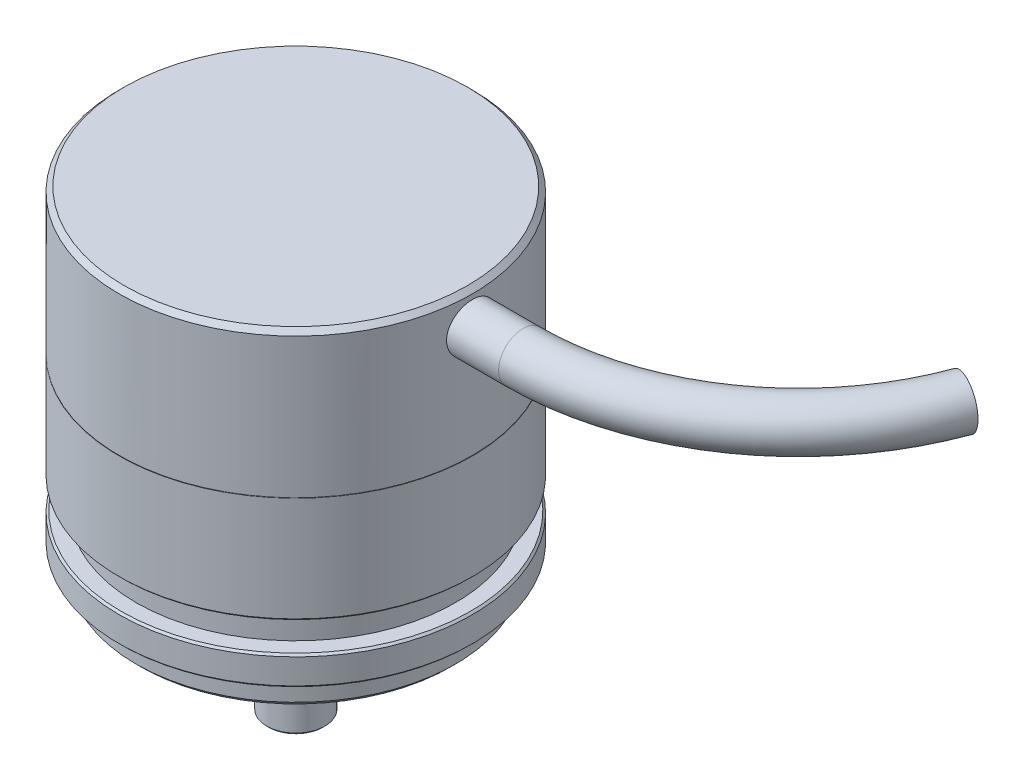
SolidWorks part; units mm, degrees
ref_plane "Plane1" through (0, 0, 0) normal (0, 0, 1) x (1, 0, 0)
ref_plane "Plane2" through (0, 0, 0) normal (0, 1, 0) x (1, 0, 0)
ref_plane "Plane3" through (0, 0, 0) normal (1, 0, 0) x (0, 0, -1)
sketch "Sketch1" plane through (0, 0, 0) normal (0, 0, 1) x (1, 0, 0)
  line L1 (49.7963, 36) -> (49.7963, 21.05)
  line L2 (41.0963, 1) -> (48.0463, 1)
  line L4 (49.7963, 4) -> (48.0463, 4)
  line L5 (49.7963, 7) -> (48.0463, 7)
  line L6 (49.7963, 4) -> (49.7963, 7)
  line L7 (48.0463, 1) -> (48.0463, 4)
  line L8 (49.7963, 10) -> (48.0463, 10)
  line L9 (48.0463, 7) -> (48.0463, 10)
  line L10 (34.5463, 1.1) -> (34.65, 1)
  line L11 (41.0963, 1) -> (41.0963, 1.1)
  line L12 (31.5463, -11) -> (34.5463, -11)
  line L13 (34.5463, -11) -> (34.5463, 1.1)
  line L14 (49.7963, 36) -> (31.5463, 36)
  line L15 (31.5463, -11) -> (31.5463, 0.4309) construction
  line L16 (34.65, 1) -> (35.4, 1)
  line L17 (35.4, 1) -> (35.4, 1.1)
  line L20 (35.4, 1.1) -> (39.5, 1.1)
  line L22 (39.75, 1.0147) -> (40.9814, 1.0147)
  line L23 (40.9814, 1.0147) -> (40.9814, 1.1)
  line L24 (40.9814, 1.1) -> (41.0963, 1.1)
  line L25 (31.5463, -11) -> (31.5463, 36)
  line L26 (49.7963, 21) -> (49.75, 21)
  line L27 (49.75, 21) -> (49.75, 21.05)
  line L28 (49.75, 21.05) -> (49.7963, 21.05)
  line L29 (49.7963, 21) -> (49.7963, 10)
  line L30 (39.5, 1.1) -> (39.75, 1.1)
  line L31 (39.75, 1.1) -> (39.75, 1.0147)
  dimension "D1" = 12
  dimension "D2" = 3
  dimension "D3" = 35
revolve "Base-Revolve" add sketch "Sketch1" angle 360 about L15
chamfer "Chamfer1" distance 0.5 angle 45 2 edges at (31.5463, 36, -18.25) (31.5463, 1, -16.5)
ref_plane "Plane4" through (20, 0, 0) normal (1, 0, 0) x (0, 0, -1)
sketch "Sketch2" plane through (20, 0, 0) normal (1, 0, 0) x (0, 0, -1)
  line L0 (0, 35.5) -> (0, 36) construction
  line L1 (17.75, 36) -> (-17.75, 36) construction
  circle A0 centre (0, 32.5) radius 2.5
  dimension "D2" = 5
  dimension "D1" = 3.5
extrude "Boss-Extrude1" add sketch "Sketch2" along normal blind 35
sketch "Sketch3" plane through (55, 0, 0) normal (1, 0, 0) x (0, 0, -1)
  line L0 (28.5, 36.7) -> (28.5, 22.8) construction
  circle A2 centre (0, 32.5) radius 2.5
  circle A3 centre (0, 32.5) radius 2.5
  dimension "D1" = 0
revolve "Boss-Revolve1" add sketch "Sketch3" angle 70 about L0
sketch "Sketch4" plane through (0, 1, 0) normal (0, -1, 0) x (1, 0, 0)
  circle A2 centre (40.7387, 9.1924) radius 1.35
  circle A4 centre (40.7387, -9.1924) radius 1.35
  circle A6 centre (22.3539, -9.1924) radius 1.35
  circle A8 centre (22.3539, 9.1924) radius 1.35
extrude "Cut-Extrude1" cut sketch "Sketch4" against normal blind 6
sketch "Sketch5" plane through (0, 7, 0) normal (0, -1, 0) x (1, 0, 0)
  circle A2 centre (40.7387, 9.1924) radius 1.35
  circle A3 centre (40.7387, 9.1924) radius 1.35
  circle A5 centre (40.7387, -9.1924) radius 1.35
  circle A6 centre (40.7387, -9.1924) radius 1.35
  circle A8 centre (22.3539, 9.1924) radius 1.35
  circle A9 centre (22.3539, 9.1924) radius 1.35
  circle A11 centre (22.3539, -9.1924) radius 1.35
  circle A12 centre (22.3539, -9.1924) radius 1.35
  dimension "D1" = 0
  dimension "D2" = 0
  dimension "D3" = 0
  dimension "D4" = 0
extrude "Cut-Extrude2" cut sketch "Sketch5" against normal blind 6 draft 60
chamfer "Chamfer2" distance 0.2 angle 45 8 edges at (31.5463, 10, -18.25) (31.5463, 7, -18.25) (31.5463, 4, -18.25) (31.5463, -11, -3) (40.7387, 1, 7.8424) (40.7387, 1, -10.5424) (22.3539, 1, -10.5424) (22.3539, 1, 7.8424)
